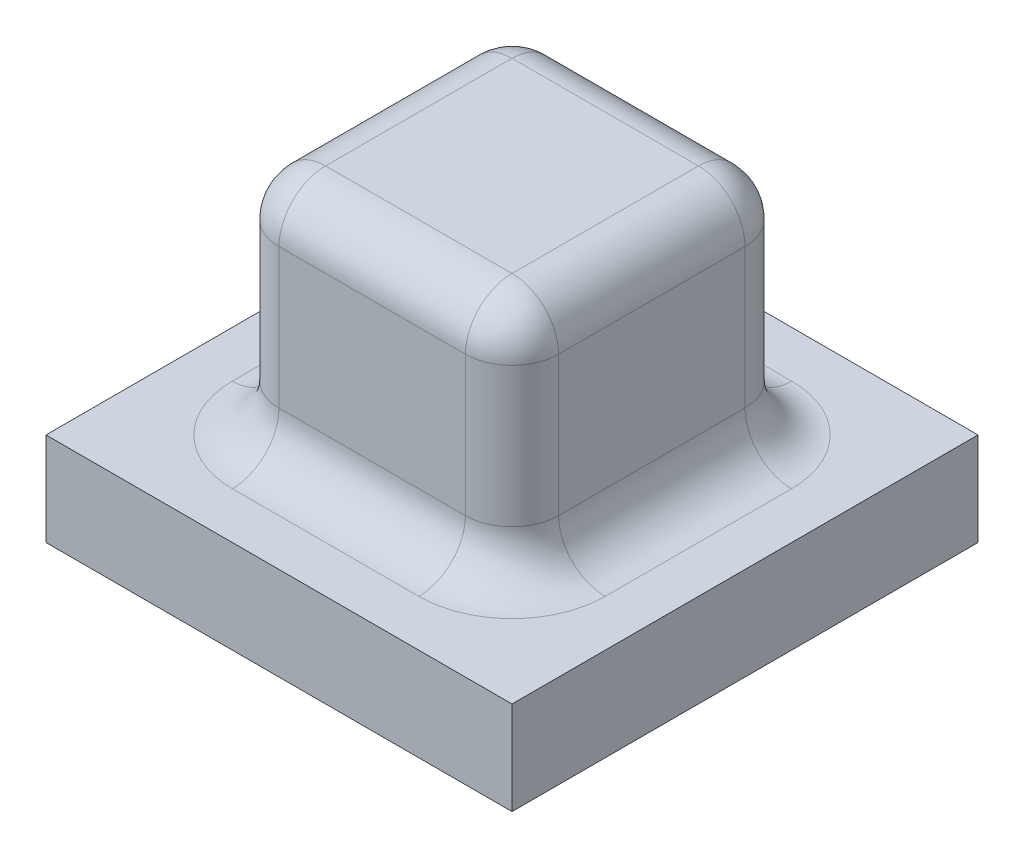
SolidWorks part; units mm, degrees
ref_plane "Front" through (0, 0, 0) normal (0, 0, 1) x (1, 0, 0)
ref_plane "Top" through (0, 0, 0) normal (0, 1, 0) x (1, 0, 0)
ref_plane "Right" through (0, 0, 0) normal (1, 0, 0) x (0, 0, -1)
sketch "Sketch1" plane through (0, 0, 0) normal (0, 0, 1) x (1, 0, 0)
  line L1 (-50, 20) -> (50, 20)
  line L2 (-50, 20) -> (-50, 0)
  line L3 (-50, 0) -> (50, 0)
  line L4 (50, 20) -> (50, 0)
  dimension "D1" = 20
  dimension "D2" = 100
extrude "Extrude1" add sketch "Sketch1" along normal mid plane 100
sketch "Sketch2" plane through (0, 20, 0) normal (0, 1, 0) x (-1, 0, 0)
  line L0 (30, -30) -> (-30, 30) construction
  line L1 (-30, 30) -> (30, 30)
  line L2 (-30, 30) -> (-30, -30)
  line L3 (-30, -30) -> (30, -30)
  line L4 (30, 30) -> (30, -30)
  dimension "D1" = 60
  dimension "D2" = 60
extrude "Extrude2" add sketch "Sketch2" along normal blind 50
fillet "Fillet6" radius 10
